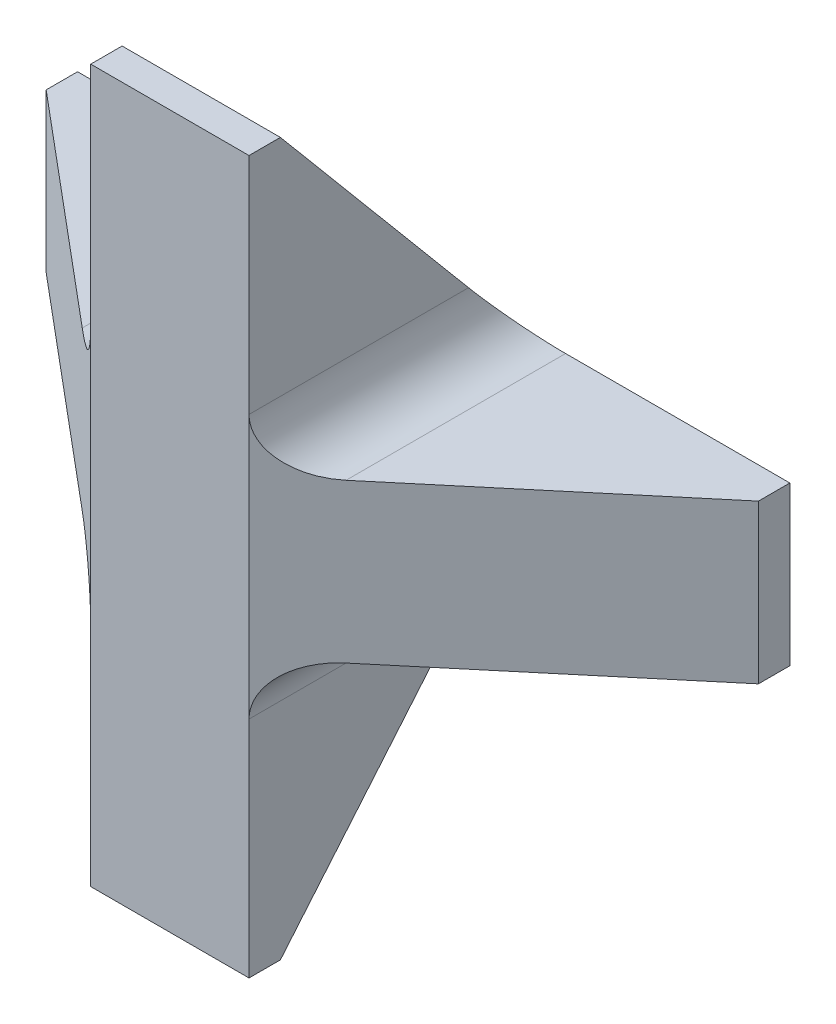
SolidWorks part; units mm, degrees
ref_plane "Front Plane" through (0, 0, 0) normal (0, 0, 1) x (1, 0, 0)
ref_plane "Top Plane" through (0, 0, 0) normal (0, 1, 0) x (1, 0, 0)
ref_plane "Right Plane" through (0, 0, 0) normal (1, 0, 0) x (0, 0, -1)
sketch "Sketch1" plane through (0, 0, 0) normal (0, 1, 0) x (1, 0, 0)
  line L0 (0, 0) -> (13.5, 0)
  line L1 (13.5, 0) -> (13.5, -5)
  line L2 (13.5, -5) -> (0, -5)
  line L3 (0, -5) -> (0, 0)
  dimension "D1" = 13.5
  dimension "D2" = 5
extrude "Boss-Extrude1" add sketch "Sketch1" along normal blind 3
ref_plane "Plane1" through (0, 0, 5) normal (0, 0, 1) x (1, 0, 0)
sketch "Sketch2" plane through (0, 0, 5) normal (0, 0, 1) x (1, 0, 0)
  line L0 (5.25, 8.25) -> (5.25, -5.25)
  line L1 (5.25, -5.25) -> (8.25, -5.25)
  line L2 (8.25, -5.25) -> (8.25, 8.25)
  line L3 (8.25, 8.25) -> (5.25, 8.25)
  line L5 (6.75, 8.25) -> (6.75, 3) construction
  line L6 (0, 3) -> (13.5, 3) construction
  line L7 (8.25, 1.5) -> (13.5, 1.5) construction
  line L8 (13.5, 3) -> (13.5, 0) construction
  dimension "D1" = 13.5
  dimension "D2" = 3
extrude "Boss-Extrude2" add sketch "Sketch2" against normal blind 5
chamfer "Chamfer2" distance 5.25 angle 40 4 edges at (6.75, 8.25, 0) (6.75, -5.25, 0) (0, 1.5, 5) (13.5, 1.5, 5)
fillet "Fillet5" radius 1 4 edges at (8.25, 0, 2.5) (5.25, 0, 2.5) (5.25, 3, 2.5) (8.25, 3, 2.5)
